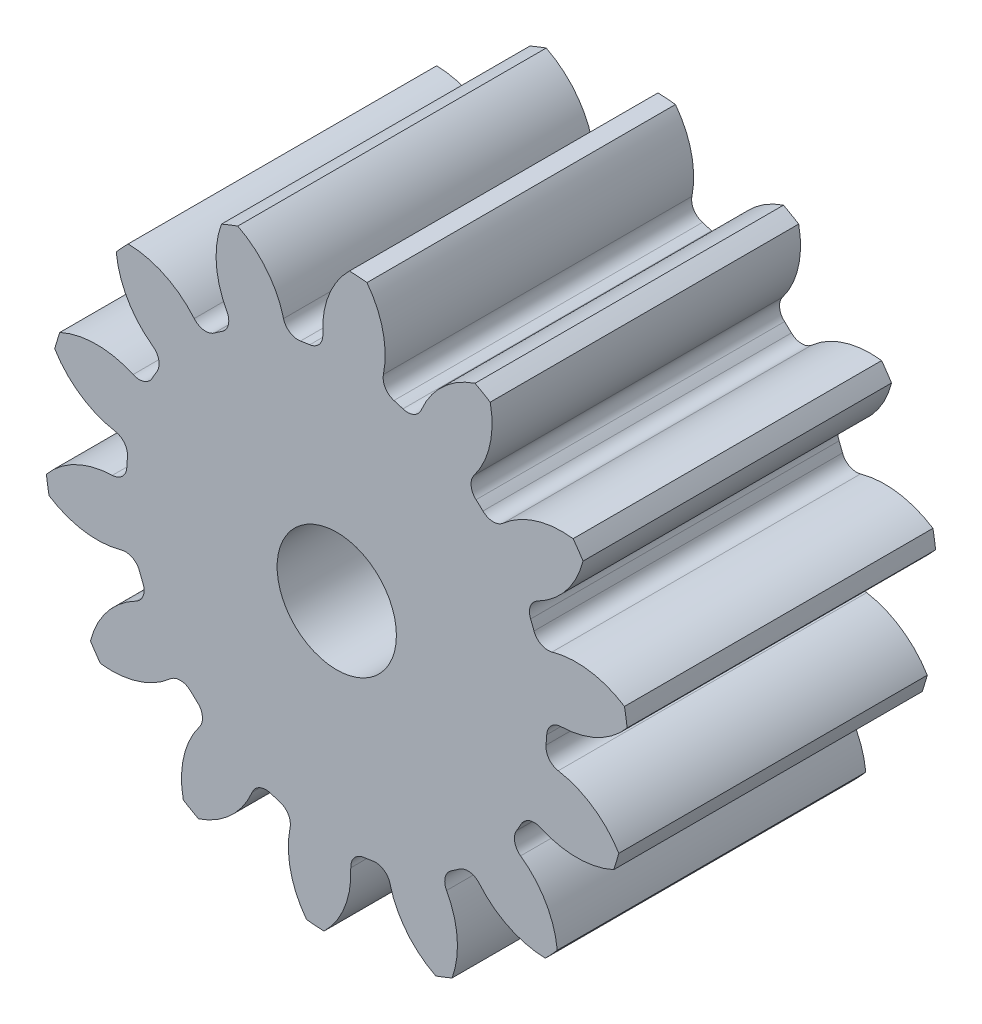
SolidWorks part; units mm, degrees
ref_plane "Front" through (0, 0, 0) normal (0, 0, 1) x (1, 0, 0)
ref_plane "Top" through (0, 0, 0) normal (0, 1, 0) x (1, 0, 0)
ref_plane "Right" through (0, 0, 0) normal (1, 0, 0) x (0, 0, -1)
sketch "Sketch3" plane through (0, 0, 0) normal (0, 0, 1) x (1, 0, 0)
  circle A0 centre (0, 0) radius 90.3111
  dimension "od" = 180.6222
extrude "gearBody" add sketch "Sketch3" along normal blind 95.25
sketch "Sketch2" plane through (0, 0, 0) normal (0, 0, 1) x (1, 0, 0)
  line L0 (0, 0) -> (68.6042, 28.4168) construction
  line L1 (87.6196, -24.8205) -> (0, 0) construction
  line L2 (0, 0) -> (36.3143, 0) construction
  line L3 (78.963, 3.0601) -> (77.6618, -14.5996) construction
  line L5 (78.3124, -5.7698) -> (0, 0) construction
  line L7 (0, 0) -> (74.2566, 0) construction
  arc A0 (74.2391, 1.6117) -> (73.2013, -12.4745) centre (0, 0) ccw construction
  arc A1 (89.6523, 10.8885) -> (87.0885, -23.9101) centre (0, 0) ccw construction
  arc A2 (78.963, 3.0601) -> (77.6618, -14.5996) centre (0, 0) ccw construction
  arc A3 (64.6131, -6.2133) -> (64.826, -3.3233) centre (0, 0) ccw
  arc A4 (87.6196, -24.8205) -> (68.3982, -11.1795) centre (63.6987, -38.1644) ccw
  arc A5 (87.6196, -24.8205) -> (90.3111, 11.7113) centre (0, 0) ccw
  arc A6 (90.3111, 11.7113) -> (69.2981, 1.0346) centre (68.6042, 28.4168) cw
  arc A7 (64.826, -3.3233) -> (69.2981, 1.0346) centre (69.4145, -3.5585) cw
  arc A8 (68.3982, -11.1795) -> (64.6131, -6.2133) centre (69.1865, -6.6531) cw
  point P6 (90.3111, 11.7113)
  point P22 (87.6196, -24.8205)
  dimension "baseDia" = 148.5132
  dimension "od" = 180.6222
  dimension "pd" = 158.0444
  dimension "rd" = 129.8222
  dimension "rFillet" = 4.5946
  dimension "pointX" = 90.3111
  dimension "pointY" = 11.7113
  dimension "CTT" = 17.6597
  dimension "flankCenterAngle" = 22.5
extrude "toothCut" cut sketch "Sketch2" along normal through all
pattern_circular "CirPattern1" count 14 over 360 about axis through (0, 0, 0) along (0, 0, 1) of "toothCut"
sketch "hub1Dia" plane through (0, 0, 0) normal (0, 0, -1) x (-1, 0, 0)
  circle A0 centre (0, 0) radius 12.7
  dimension "hub1Dia" = 25.4
sketch "hub2Dia" plane through (0, 0, 95.25) normal (0, 0, 1) x (1, 0, 0)
  circle A0 centre (0, 0) radius 12.7
  dimension "hub2dia" = 25.4
sketch "boreDia" plane through (0, 0, 0) normal (0, 0, 1) x (1, 0, 0)
  circle A0 centre (0, 0) radius 18.415
  dimension "boreDia" = 36.83
extrude "bore" cut sketch "boreDia" against normal mid plane 25400
